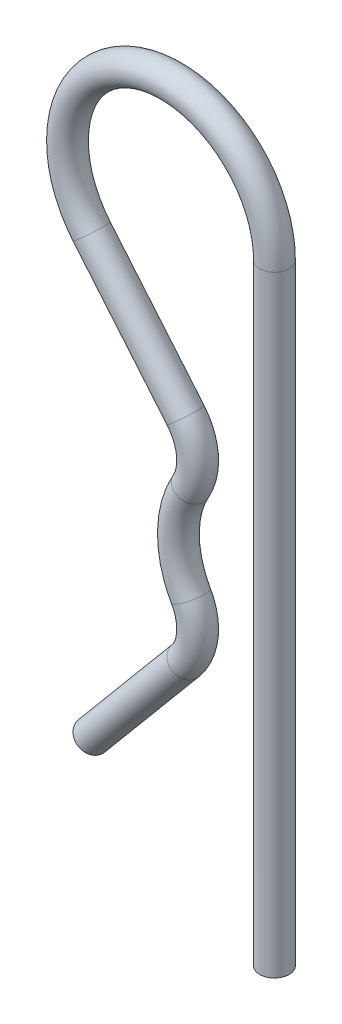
SolidWorks part; units mm, degrees
ref_plane "Plan1" through (0, 0, 0) normal (0, 0, 1) x (1, 0, 0)
ref_plane "Plan2" through (0, 0, 0) normal (0, 1, 0) x (1, 0, 0)
ref_plane "Plan3" through (0, 0, 0) normal (1, 0, 0) x (0, 0, -1)
sketch "Esquisse1" plane through (0, 0, 0) normal (0, 0, 1) x (1, 0, 0)
  line L0 (0, 0) -> (0, 20.625) construction
  line L1 (-9.2757, 11.081) -> (-4.5096, 5.3873) construction
  line L2 (0, 0) -> (-20.625, 0) construction
  line L4 (0, 14.4509) -> (0, 0) construction
  line L5 (0, 0) -> (0, -16.5491) construction
  line L6 (-5.25, 19.7009) -> (0, 19.7009) construction
  line L7 (-9.2757, -11.081) -> (-4.5096, -5.3873) construction
  circle A0 centre (0, 0) radius 20.625 construction
  arc A1 (0, 14.4509) -> (-9.2757, 11.081) centre (-5.25, 14.4509) ccw construction
  arc A2 (-4.2396, 2.4065) -> (-4.2396, -2.4065) centre (0, 0) ccw construction
  arc A3 (-4.5096, 5.3873) -> (-4.2396, 2.4065) centre (-6.5225, 3.7024) cw construction
  arc A5 (-4.2396, -2.4065) -> (-4.5096, -5.3873) centre (-6.5225, -3.7024) cw
  dimension "D1" = 41.25
  dimension "D2" = 10.5
  dimension "D3" = 9.75
  dimension "D7" = 2.625
  dimension "D4" = 2.625
  dimension "D6" = 36.25
sketch "Esquisse4" plane through (0, 0, 0) normal (0, 0, 1) x (1, 0, 0)
  line L7 (0, -16.5491) -> (0, 14.4509)
  line L8 (-9.2757, 11.081) -> (-4.5096, 5.3873) construction
  line L9 (-9.2757, 11.081) -> (-4.5096, 5.3873)
  line L10 (-9.2757, -11.081) -> (-4.5096, -5.3873) construction
  line L11 (-9.2757, -11.081) -> (-4.5096, -5.3873)
  arc A7 (0, 14.4509) -> (-9.2757, 11.081) centre (-5.25, 14.4509) ccw construction
  arc A8 (0, 14.4509) -> (-9.2757, 11.081) centre (-5.25, 14.4509) ccw
  arc A9 (-4.5096, -5.3873) -> (-4.2396, -2.4065) centre (-6.5225, -3.7024) ccw construction
  arc A10 (-4.2396, 2.4065) -> (-4.2396, -2.4065) centre (0, 0) ccw construction
  arc A11 (-4.2396, 2.4065) -> (-4.5096, 5.3873) centre (-6.5225, 3.7024) ccw construction
  arc A12 (-4.5096, -5.3873) -> (-4.2396, -2.4065) centre (-6.5225, -3.7024) ccw
  arc A13 (-4.2396, 2.4065) -> (-4.2396, -2.4065) centre (0, 0) ccw
  arc A14 (-4.2396, 2.4065) -> (-4.5096, 5.3873) centre (-6.5225, 3.7024) ccw
ref_plane "Plan5" through (0, -16.5491, 0) normal (0, 1, 0) x (-1, 0, 0)
sketch "Esquisse2" plane through (0, -16.5491, 0) normal (0, 1, 0) x (1, 0, 0)
  circle A0 centre (0, 0) radius 0.75
  dimension "D1" = 1.5
sweep "Base-Balayage" add profiles "Esquisse2" path "Esquisse4"
equation "\"D7@Esquisse1\"=\"D2@Esquisse1\"/4"
equation "\"D4@Esquisse1\"=\"D7@Esquisse1\""
